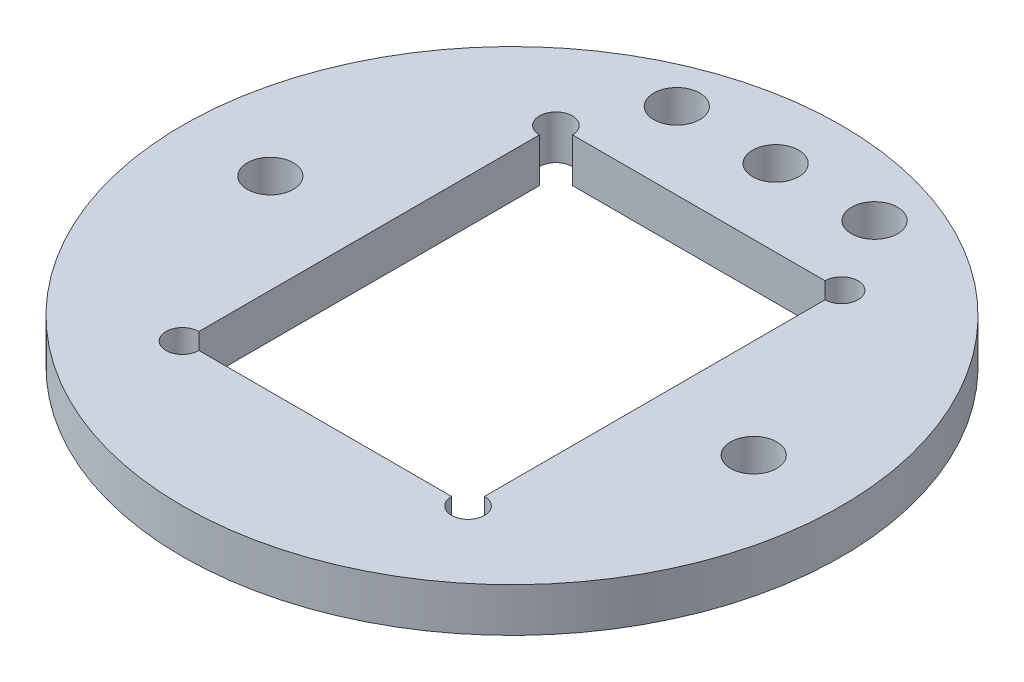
SolidWorks part; units mm, degrees
ref_plane "Front Plane" through (0, 0, 0) normal (0, 0, 1) x (1, 0, 0)
ref_plane "Top Plane" through (0, 0, 0) normal (0, 1, 0) x (1, 0, 0)
ref_plane "Right Plane" through (0, 0, 0) normal (1, 0, 0) x (0, 0, -1)
sketch "Sketch1" plane through (0, 0, 0) normal (0, 1, 0) x (1, 0, 0)
  line L1 (-0.762, -1.5748) -> (0.762, -1.7018) construction
  line L2 (-0.762, -2.0828) -> (0.762, -2.0828)
  line L3 (-1.143, -1.7018) -> (-1.143, -1.5748)
  line L4 (-0.762, -1.1938) -> (0.762, -1.1938)
  line L5 (1.143, -1.7018) -> (1.143, -1.5748)
  line L6 (0, 0) -> (0, -1.6383) construction
  line L7 (0, -1.6383) -> (0, -2.667) construction
  line L8 (-1.27, -2.667) -> (1.27, -2.667) construction
  line L9 (-1.27, -2.667) -> (-1.27, -1.143) construction
  line L10 (-1.27, -1.143) -> (1.27, -1.143) construction
  line L11 (1.27, -2.667) -> (1.27, -1.143) construction
  line L12 (-1.27, -1.905) -> (-2.4839, -1.905) construction
  circle A0 centre (0, 0) radius 3.81
  arc A1 (0.762, -2.0828) -> (1.143, -1.7018) centre (0.762, -1.7018) ccw
  arc A2 (0.762, -1.1938) -> (1.143, -1.5748) centre (0.762, -1.5748) cw
  arc A3 (-1.143, -1.5748) -> (-0.762, -1.1938) centre (-0.762, -1.5748) cw
  arc A4 (-0.762, -2.0828) -> (-1.143, -1.7018) centre (-0.762, -1.7018) cw
  dimension "D1" = 7.62
  dimension "D3" = 0.381
  dimension "D2" = 1.143
  dimension "D4" = 0.889
  dimension "D5" = 1.1938
  dimension "D6" = 2.286
  dimension "D7" = 1.524
  dimension "D8" = 2.54
extrude "Extrude1" add sketch "Sketch1" along normal blind 0.508
sketch "Sketch2" plane through (0, 0.508, 0) normal (0, 1, 0) x (1, 0, 0)
  line L3 (-2.794, 0) -> (2.794, 0) construction
  circle A0 centre (2.794, 0) radius 0.2667
  circle A1 centre (-2.794, 0) radius 0.2667
  point P3 (0, 0)
  dimension "D2" = 0.5334
  dimension "D1" = 5.588
extrude "Alighnment holes" cut sketch "Sketch2" along normal blind 2.54 and the other way through all
sketch "Sketch5" plane through (0, 0, 0) normal (0, -1, 0) x (1, 0, 0)
  line L0 (1.143, 1.7018) -> (1.143, 1.5748) construction
  line L1 (-0.762, 2.0828) -> (0.762, 2.0828) construction
  line L2 (-0.3175, 2.0828) -> (0.3175, 2.0828)
  line L3 (-0.3175, 2.0828) -> (-0.3175, 3.3528)
  line L4 (-0.3175, 3.3528) -> (0.762, 3.3528)
  line L5 (-0.762, 1.1938) -> (0.762, 1.1938) construction
  line L6 (0.3175, 2.0828) -> (0.3175, 2.8448)
  line L7 (-0.5715, 2.0828) -> (-0.3175, 2.0828) construction
  line L8 (0.5715, 2.0828) -> (0.762, 2.0828)
  line L9 (0.5715, 2.0828) -> (0.5715, 2.5908)
  line L10 (0.5715, 2.5908) -> (0.762, 2.5908)
  line L11 (1.143, 1.7018) -> (1.143, 1.5748)
  line L12 (0.762, 2.0828) -> (0.762, 2.5908) construction
  line L13 (-0.762, 1.1938) -> (-0.6985, 1.1938)
  line L14 (-0.4445, -3.784) -> (-0.4445, 1.1938)
  line L15 (0.4445, -3.784) -> (0.4445, 0.6858)
  line L16 (0.3175, 2.0828) -> (0.5715, 2.0828) construction
  line L17 (0, 2.0828) -> (0, 1.6383) construction
  line L18 (-0.6985, -3.7454) -> (-0.6985, 1.1938)
  line L19 (1.143, 1.7018) -> (1.651, 1.7018) construction
  line L20 (-1.5875, -3.4635) -> (-1.5875, 1.2448)
  line L21 (0.6985, -3.7454) -> (0.6985, 0.4318)
  line L22 (0.762, 2.8448) -> (0.3175, 2.8448)
  line L23 (1.5875, -3.4635) -> (1.5875, 0.145)
  line L24 (-0.4445, -3.784) -> (0.4445, -3.784) construction
  line L25 (0, -3.784) -> (0, 0) construction
  line L26 (1.651, 1.7018) -> (1.651, 1.5748)
  line L27 (0.4445, 0.6858) -> (0.762, 0.6858)
  line L28 (1.905, 1.7018) -> (1.905, 1.5748)
  line L29 (1.905, 1.7018) -> (2.413, 1.7018) construction
  line L30 (2.413, 1.7018) -> (2.413, 1.5748)
  line L31 (0.3175, 2.8448) -> (0.3175, 3.3528) construction
  line L32 (0.5715, 2.5908) -> (0.5715, 2.8448) construction
  line L33 (-0.4445, 1.1938) -> (0.762, 1.1938)
  line L34 (-1.5875, -3.4635) -> (-0.6985, -3.4635) construction
  line L35 (1.5875, -3.4635) -> (0.6985, -3.4635) construction
  line L36 (-1.143, 1.5748) -> (-1.143, 1.7018)
  line L37 (-0.5715, 2.8448) -> (-0.762, 2.8448)
  line L38 (-1.651, 1.5748) -> (-1.651, 1.7018)
  line L39 (-0.5715, 2.0828) -> (-0.762, 2.0828)
  line L40 (-0.5715, 2.0828) -> (-0.5715, 2.5908)
  line L41 (-0.5715, 2.5908) -> (-0.762, 2.5908)
  line L42 (-1.905, 1.5748) -> (-1.905, 1.7018)
  line L43 (-1.8415, -3.042) -> (-1.8415, 1.1991)
  line L44 (2.667, 2.3521) -> (2.667, 1.5748)
  line L45 (1.8415, -3.042) -> (1.8415, 0.0052)
  line L46 (-0.5715, 2.8448) -> (-0.5715, 3.5098)
  line L47 (2.667, 1.7018) -> (2.667, 1.5748) construction
  line L48 (-1.8415, -3.4635) -> (-1.8415, 1.1991) construction
  line L49 (1.8415, -3.4635) -> (1.8415, 0.0052) construction
  line L50 (0.6985, 0.4318) -> (0.762, 0.4318)
  arc A0 (1.143, 1.7018) -> (0.762, 2.0828) centre (0.762, 1.7018) ccw construction
  arc A1 (1.143, 1.7018) -> (0.762, 2.0828) centre (0.762, 1.7018) ccw
  arc A2 (0.762, 2.5908) -> (1.651, 1.7018) centre (0.762, 1.7018) cw
  arc A3 (-0.762, 2.0828) -> (-1.143, 1.7018) centre (-0.762, 1.7018) ccw construction
  arc A4 (0.762, 1.1938) -> (1.143, 1.5748) centre (0.762, 1.5748) ccw construction
  arc A5 (-0.762, 2.0828) -> (-1.143, 1.7018) centre (-0.762, 1.7018) ccw
  arc A6 (1.905, 1.5748) -> (0.762, 0.4318) centre (0.762, 1.5748) cw
  arc A7 (2.413, 1.5748) -> (1.5875, 0.145) centre (0.762, 1.5748) cw
  arc A8 (0.762, 1.1938) -> (1.143, 1.5748) centre (0.762, 1.5748) ccw
  circle A9 centre (0, 0) radius 3.81 construction
  arc A10 (1.905, 1.7018) -> (0.762, 2.8448) centre (0.762, 1.7018) ccw
  arc A11 (2.413, 1.7018) -> (0.762, 3.3528) centre (0.762, 1.7018) ccw
  arc A12 (-1.905, 1.7018) -> (-0.762, 2.8448) centre (-0.762, 1.7018) cw
  arc A13 (-1.5875, -3.4635) -> (-0.6985, -3.7454) centre (0, 0) ccw
  arc A14 (1.651, 1.5748) -> (0.762, 0.6858) centre (0.762, 1.5748) cw
  arc A15 (-1.143, 1.5748) -> (-0.762, 1.1938) centre (-0.762, 1.5748) ccw construction
  arc A16 (-1.651, 1.7018) -> (-0.762, 2.5908) centre (-0.762, 1.7018) cw
  arc A17 (-1.905, 1.5748) -> (-1.8415, 1.1991) centre (-0.762, 1.5748) ccw
  arc A18 (-1.143, 1.5748) -> (-0.762, 1.1938) centre (-0.762, 1.5748) ccw
  arc A19 (-1.651, 1.5748) -> (-1.5875, 1.2448) centre (-0.762, 1.5748) ccw
  arc A20 (2.667, 1.5748) -> (1.8415, 0.0052) centre (0.762, 1.5748) cw
  arc A22 (-0.4445, -3.784) -> (0.4445, -3.784) centre (0, 0) ccw
  arc A23 (0.6985, -3.7454) -> (1.5875, -3.4635) centre (0, 0) ccw
  arc A27 (-0.5715, 3.5098) -> (-1.8415, -3.042) centre (0, 0) ccw
  arc A30 (1.8415, -3.042) -> (2.667, 2.3521) centre (0, 0) ccw
  circle A50 centre (-2.794, 0) radius 0.3937
  circle A51 centre (-2.794, 0) radius 0.3937
  circle A53 centre (2.794, 0) radius 0.3937
  circle A54 centre (2.794, 0) radius 0.3937
  dimension "D2" = 0.254
  dimension "D4" = 0.889
  dimension "D5" = 0.254
  dimension "D6" = 0.254
  dimension "D9" = 7.112
  dimension "D1" = 0.635
  dimension "D3" = 0.508
  dimension "D7" = 0.254
  dimension "D8" = 0.254
  dimension "D10" = 0.127
  dimension "D11" = 0.127
extrude "Traces" [suppressed] add sketch "Sketch5" along normal blind 0.0254
sketch "Sketch16" plane through (0, 0.508, 0) normal (0, -1, 0) x (1, 0, 0)
  line L0 (-1.143, -3.048) -> (0, -3.048) construction
  line L1 (0, -3.048) -> (1.143, -3.048) construction
  circle A0 centre (0, -3.048) radius 0.2667
  circle A1 centre (1.143, -3.048) radius 0.2667
  circle A2 centre (-1.143, -3.048) radius 0.2667
  dimension "D3" = 0.5334
  dimension "D1" = 1.143
  dimension "D2" = 3.048
extrude "Cut-Extrude7" cut sketch "Sketch16" along normal through all
sketch "ChipPocket" plane through (0, 0.508, 0) normal (0, 1, 0) x (1, 0, 0)
  line L0 (-1.651, -2.159) -> (1.651, 2.159) construction
  line L1 (-1.4605, 2.159) -> (1.4605, 2.159)
  line L2 (-1.651, 1.9685) -> (-1.651, -1.9685)
  line L3 (-1.4605, -2.159) -> (1.4605, -2.159)
  line L4 (1.651, 1.9685) -> (1.651, -1.9685)
  arc A0 (-1.4605, 2.159) -> (-1.651, 1.9685) centre (-1.651, 2.159) ccw
  arc A1 (1.651, 1.9685) -> (1.4605, 2.159) centre (1.651, 2.159) ccw
  arc A2 (1.4605, -2.159) -> (1.651, -1.9685) centre (1.651, -2.159) ccw
  arc A3 (-1.651, -1.9685) -> (-1.4605, -2.159) centre (-1.651, -2.159) ccw
  circle A4 centre (0, 0) radius 3.81 construction
  circle A5 centre (2.794, 0) radius 0.2667 construction
  circle A6 centre (-2.794, 0) radius 0.2667 construction
  circle A7 centre (0, 0) radius 3.81
  circle A8 centre (2.794, 0) radius 0.2667
  circle A9 centre (-2.794, 0) radius 0.2667
  dimension "D1" = 4.318
  dimension "D3" = 0.381
  dimension "D2" = 3.302
sketch "Sketch17" plane through (0, 0, 0) normal (0, -1, 0) x (1, 0, 0)
  line L4 (-1.27, 2.286) -> (-1.27, 1.524)
  line L5 (-0.889, 2.667) -> (0.889, 2.667)
  line L6 (1.27, 2.286) -> (1.27, 1.524)
  line L7 (-0.889, 1.143) -> (0.889, 1.143)
  line L8 (-1.27, 1.143) -> (1.27, 1.143) construction
  line L9 (-1.27, 2.667) -> (1.27, 2.667) construction
  line L10 (-1.27, 2.667) -> (-1.27, 1.143) construction
  line L11 (1.27, 2.667) -> (1.27, 1.143) construction
  arc A0 (-0.889, 1.143) -> (-1.27, 1.524) centre (-0.889, 1.524) cw
  arc A1 (-0.889, 2.667) -> (-1.27, 2.286) centre (-0.889, 2.286) ccw
  arc A2 (0.889, 2.667) -> (1.27, 2.286) centre (0.889, 2.286) cw
  arc A3 (0.889, 1.143) -> (1.27, 1.524) centre (0.889, 1.524) ccw
  dimension "D1" = 0.381
extrude "BottomPocket" [suppressed] cut sketch "Sketch17" against normal through all
sketch "Sketch18" plane through (0, 0, 0) normal (0, -1, 0) x (1, 0, 0)
  line L0 (-1.4605, -3.048) -> (-1.4605, -3.81)
  line L1 (-0.8255, -3.048) -> (-0.8255, -3.81)
  line L2 (-0.3175, -3.048) -> (-0.3175, -3.81)
  line L3 (0.3175, -3.048) -> (0.3175, -3.81)
  line L4 (0.8255, -3.048) -> (0.8255, -3.81)
  line L5 (1.4605, -3.048) -> (1.4605, -3.81)
  line L6 (-1.4605, -3.81) -> (-0.8255, -3.81)
  line L7 (-0.3175, -3.81) -> (0.3175, -3.81)
  line L8 (0.8255, -3.81) -> (1.4605, -3.81)
  arc A53 (0.3175, -3.048) -> (-0.3175, -3.048) centre (0, -3.048) ccw
  arc A54 (1.4605, -3.048) -> (0.8255, -3.048) centre (1.143, -3.048) ccw
  arc A55 (-0.8255, -3.048) -> (-1.4605, -3.048) centre (-1.143, -3.048) ccw
  circle A56 centre (0, -3.048) radius 0.2667 construction
  circle A57 centre (1.143, -3.048) radius 0.2667 construction
  circle A58 centre (0, 0) radius 3.81 construction
  circle A59 centre (-1.143, -3.048) radius 0.2667 construction
  dimension "D1" = 0.635
extrude "BottomWires" [suppressed] cut sketch "Sketch18" against normal through all
extrude "Cut-Extrude8" cut sketch "ChipPocket" against normal through all flip side to cut
